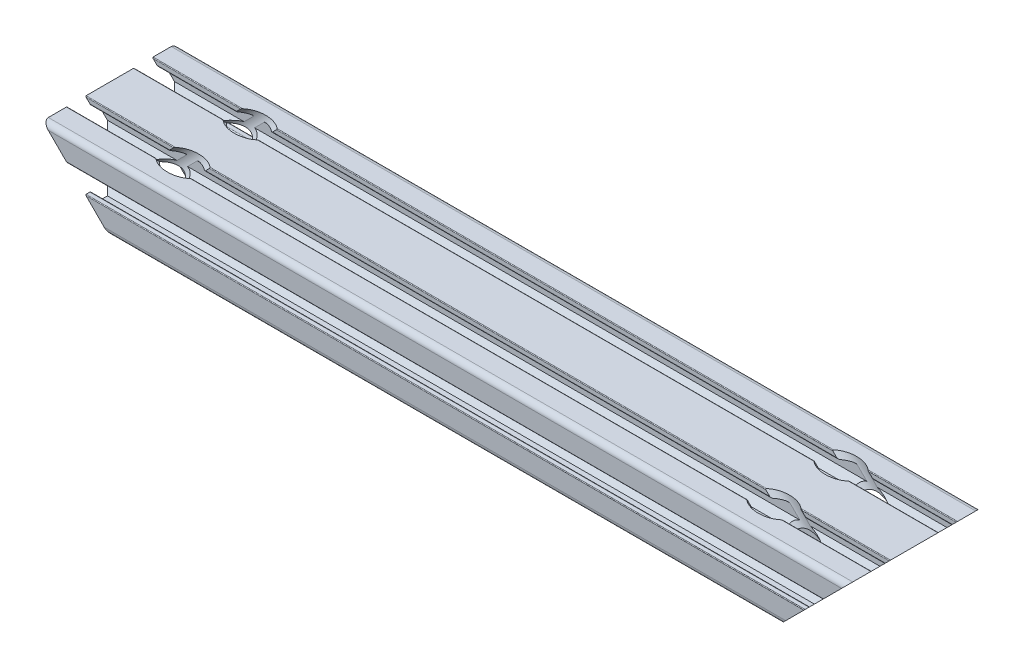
SolidWorks part; units mm, degrees
ref_plane "Front Plane" through (0, 0, 0) normal (0, 0, 1) x (1, 0, 0)
ref_plane "Top Plane" through (0, 0, 0) normal (0, 1, 0) x (1, 0, 0)
ref_plane "Right Plane" through (0, 0, 0) normal (1, 0, 0) x (0, 0, -1)
sketch3d "3DSketch1"
  line L0 (180, 0, 0) -> (-180, 0, 0)
  dimension "D1" = 360
  dimension "D2" = 180
other "30-sarja 1.0012 30X60(1)"
ref_plane "Plane1" through (180, 0, 0) normal (-1, 0, 0) x (0, 1, 0)
sketch "Model" plane through (180, 0, 0) normal (-1, 0, 0) x (0, 1, 0)
  line L0 (-2.0858, 18.5) -> (-3, 18.5)
  line L1 (-3.5, 18) -> (-3.5, 17.0858)
  line L2 (-3.5, 17.0858) -> (-3.3633, 16.9491)
  line L3 (-3.3633, 13.0509) -> (-3.5, 12.9142)
  line L4 (-3.5, 12.9142) -> (-3.5, 12)
  line L5 (-3, 11.5) -> (-2.0858, 11.5)
  line L6 (-2.0858, 11.5) -> (-1.9491, 11.6367)
  line L7 (1.9491, 11.6367) -> (2.0858, 11.5)
  line L8 (2.0858, 11.5) -> (3, 11.5)
  line L9 (3.5, 12) -> (3.5, 12.9142)
  line L10 (3.5, 12.9142) -> (3.3633, 13.0509)
  line L11 (3.3633, 16.9491) -> (3.5, 17.0858)
  line L12 (3.5, 17.0858) -> (3.5, 18)
  line L13 (3, 18.5) -> (2.0858, 18.5)
  line L14 (2.0858, 18.5) -> (1.9491, 18.3633)
  line L15 (-1.9491, 18.3633) -> (-2.0858, 18.5)
  line L16 (-3.5251, -10) -> (3.5251, -10)
  line L17 (4.2322, -9.7071) -> (6.4464, -7.4929)
  line L18 (7.1535, -7.2) -> (13.5, -7.2)
  line L19 (14, -6.7) -> (14, 6.7)
  line L20 (13.5, 7.2) -> (7.1535, 7.2)
  line L21 (6.4464, 7.4929) -> (4.2322, 9.7071)
  line L22 (3.5251, 10) -> (-3.5251, 10)
  line L23 (-4.2322, 9.7071) -> (-6.4464, 7.4929)
  line L24 (-7.1535, 7.2) -> (-13.5, 7.2)
  line L25 (-14, 6.7) -> (-14, -6.7)
  line L26 (-13.5, -7.2) -> (-7.1535, -7.2)
  line L27 (-6.4464, -7.4929) -> (-4.2322, -9.7071)
  line L28 (1.9491, -18.3633) -> (2.0858, -18.5)
  line L29 (2.0858, -18.5) -> (3, -18.5)
  line L30 (3.5, -18) -> (3.5, -17.0858)
  line L31 (3.5, -17.0858) -> (3.3633, -16.9491)
  line L32 (3.3633, -13.0509) -> (3.5, -12.9142)
  line L33 (3.5, -12.9142) -> (3.5, -12)
  line L34 (3, -11.5) -> (2.0858, -11.5)
  line L35 (2.0858, -11.5) -> (1.9491, -11.6367)
  line L36 (-1.9491, -11.6367) -> (-2.0858, -11.5)
  line L37 (-2.0858, -11.5) -> (-3, -11.5)
  line L38 (-3.5, -12) -> (-3.5, -12.9142)
  line L39 (-3.5, -12.9142) -> (-3.3633, -13.0509)
  line L40 (-3.3633, -16.9491) -> (-3.5, -17.0858)
  line L41 (-3.5, -17.0858) -> (-3.5, -18)
  line L42 (-3, -18.5) -> (-2.0858, -18.5)
  line L43 (-2.0858, -18.5) -> (-1.9491, -18.3633)
  line L44 (-6.8, -22.8607) -> (-3.9393, -20)
  line L45 (-6.8, -27.2) -> (-6.8, -22.8607)
  line L46 (-4.6, -27.5) -> (-6.5, -27.5)
  line L47 (-4.1, -29.7) -> (-4.1, -28)
  line L48 (-12.5, -30) -> (-4.4, -30)
  line L49 (-15, -19.4) -> (-15, -27.5)
  line L50 (-13, -19.1) -> (-14.7, -19.1)
  line L51 (-12.5, -21.5) -> (-12.5, -19.6)
  line L52 (-7.8607, -21.8) -> (-12.2, -21.8)
  line L53 (-5, -18.9393) -> (-7.8607, -21.8)
  line L54 (-5, -11.0607) -> (-5, -18.9393)
  line L55 (-7.8607, -8.2) -> (-5, -11.0607)
  line L56 (-12.2, -8.2) -> (-7.8607, -8.2)
  line L57 (-12.5, -10.4) -> (-12.5, -8.5)
  line L58 (-14.7, -10.9) -> (-13, -10.9)
  line L59 (-15, 10.6) -> (-15, -10.6)
  line L60 (-13, 10.9) -> (-14.7, 10.9)
  line L61 (-12.5, 8.5) -> (-12.5, 10.4)
  line L62 (-7.8607, 8.2) -> (-12.2, 8.2)
  line L63 (-5, 11.0607) -> (-7.8607, 8.2)
  line L64 (-5, 18.9393) -> (-5, 11.0607)
  line L65 (-7.8607, 21.8) -> (-5, 18.9393)
  line L66 (-12.2, 21.8) -> (-7.8607, 21.8)
  line L67 (-12.5, 19.6) -> (-12.5, 21.5)
  line L68 (-14.7, 19.1) -> (-13, 19.1)
  line L69 (-15, 27.5) -> (-15, 19.4)
  line L70 (-4.4, 30) -> (-12.5, 30)
  line L71 (-4.1, 28) -> (-4.1, 29.7)
  line L72 (-6.5, 27.5) -> (-4.6, 27.5)
  line L73 (-6.8, 22.8607) -> (-6.8, 27.2)
  line L74 (-3.9393, 20) -> (-6.8, 22.8607)
  line L75 (3.9393, 20) -> (-3.9393, 20)
  line L76 (6.8, 22.8607) -> (3.9393, 20)
  line L77 (6.8, 27.2) -> (6.8, 22.8607)
  line L78 (4.6, 27.5) -> (6.5, 27.5)
  line L79 (4.1, 29.7) -> (4.1, 28)
  line L80 (12.5, 30) -> (4.4, 30)
  line L81 (15, 19.4) -> (15, 27.5)
  line L82 (13, 19.1) -> (14.7, 19.1)
  line L83 (12.5, 21.5) -> (12.5, 19.6)
  line L84 (7.8607, 21.8) -> (12.2, 21.8)
  line L85 (5, 18.9393) -> (7.8607, 21.8)
  line L86 (5, 11.0607) -> (5, 18.9393)
  line L87 (7.8607, 8.2) -> (5, 11.0607)
  line L88 (12.2, 8.2) -> (7.8607, 8.2)
  line L89 (12.5, 10.4) -> (12.5, 8.5)
  line L90 (14.7, 10.9) -> (13, 10.9)
  line L91 (15, -10.6) -> (15, 10.6)
  line L92 (13, -10.9) -> (14.7, -10.9)
  line L93 (12.5, -8.5) -> (12.5, -10.4)
  line L94 (7.8607, -8.2) -> (12.2, -8.2)
  line L95 (5, -11.0607) -> (7.8607, -8.2)
  line L96 (5, -18.9393) -> (5, -11.0607)
  line L97 (7.8607, -21.8) -> (5, -18.9393)
  line L98 (12.2, -21.8) -> (7.8607, -21.8)
  line L99 (12.5, -19.6) -> (12.5, -21.5)
  line L100 (14.7, -19.1) -> (13, -19.1)
  line L101 (15, -27.5) -> (15, -19.4)
  line L102 (4.4, -30) -> (12.5, -30)
  line L103 (4.1, -28) -> (4.1, -29.7)
  line L104 (6.5, -27.5) -> (4.6, -27.5)
  line L105 (6.8, -22.8607) -> (6.8, -27.2)
  line L106 (3.9393, -20) -> (6.8, -22.8607)
  line L107 (-3.9393, -20) -> (3.9393, -20)
  circle A0 centre (10.9, 25.9) radius 3.1
  arc A1 (-3, 18.5) -> (-3.5, 18) centre (-3, 18) ccw
  arc A2 (-3.3056, 16.6059) -> (-3.3633, 16.9491) centre (-3.5754, 16.7369) ccw
  arc A3 (-3.3056, 16.6059) -> (-3.3056, 13.3941) centre (0, 15) ccw
  arc A4 (-3.3633, 13.0509) -> (-3.3056, 13.3941) centre (-3.5754, 13.2631) ccw
  arc A5 (-3.5, 12) -> (-3, 11.5) centre (-3, 12) ccw
  arc A6 (-1.6059, 11.6944) -> (-1.9491, 11.6367) centre (-1.7369, 11.4246) ccw
  arc A7 (-1.6059, 11.6944) -> (1.6059, 11.6944) centre (0, 15) ccw
  arc A8 (1.9491, 11.6367) -> (1.6059, 11.6944) centre (1.7369, 11.4246) ccw
  arc A9 (3, 11.5) -> (3.5, 12) centre (3, 12) ccw
  arc A10 (3.3056, 13.3941) -> (3.3633, 13.0509) centre (3.5754, 13.263) ccw
  arc A11 (3.3056, 13.3941) -> (3.3056, 16.6059) centre (0, 15) ccw
  arc A12 (3.3633, 16.9491) -> (3.3056, 16.6059) centre (3.5754, 16.7369) ccw
  arc A13 (3.5, 18) -> (3, 18.5) centre (3, 18) ccw
  arc A14 (1.6059, 18.3056) -> (1.9491, 18.3633) centre (1.7369, 18.5754) ccw
  arc A15 (1.6059, 18.3056) -> (-1.6059, 18.3056) centre (0, 15) ccw
  arc A16 (-1.9491, 18.3633) -> (-1.6059, 18.3056) centre (-1.7369, 18.5754) ccw
  arc A17 (-4.2322, -9.7071) -> (-3.5251, -10) centre (-3.5251, -9) ccw
  arc A18 (3.5251, -10) -> (4.2322, -9.7071) centre (3.5251, -9) ccw
  arc A19 (7.1535, -7.2) -> (6.4464, -7.4929) centre (7.1535, -8.2) ccw
  arc A20 (13.5, -7.2) -> (14, -6.7) centre (13.5, -6.7) ccw
  arc A21 (14, 6.7) -> (13.5, 7.2) centre (13.5, 6.7) ccw
  arc A22 (6.4464, 7.4929) -> (7.1535, 7.2) centre (7.1535, 8.2) ccw
  arc A23 (4.2322, 9.7071) -> (3.5251, 10) centre (3.5251, 9) ccw
  arc A24 (-3.5251, 10) -> (-4.2322, 9.7071) centre (-3.5251, 9) ccw
  arc A25 (-7.1535, 7.2) -> (-6.4464, 7.4929) centre (-7.1535, 8.2) ccw
  arc A26 (-13.5, 7.2) -> (-14, 6.7) centre (-13.5, 6.7) ccw
  arc A27 (-14, -6.7) -> (-13.5, -7.2) centre (-13.5, -6.7) ccw
  arc A28 (-6.4464, -7.4929) -> (-7.1535, -7.2) centre (-7.1535, -8.2) ccw
  arc A29 (3, -18.5) -> (3.5, -18) centre (3, -18) ccw
  arc A30 (3.3056, -16.6059) -> (3.3633, -16.9491) centre (3.5754, -16.737) ccw
  arc A31 (3.3056, -16.6059) -> (3.3056, -13.3941) centre (0, -15) ccw
  arc A32 (3.3633, -13.0509) -> (3.3056, -13.3941) centre (3.5754, -13.2631) ccw
  arc A33 (3.5, -12) -> (3, -11.5) centre (3, -12) ccw
  arc A34 (1.6059, -11.6944) -> (1.9491, -11.6367) centre (1.7369, -11.4246) ccw
  arc A35 (1.6059, -11.6944) -> (-1.6059, -11.6944) centre (0, -15) ccw
  arc A36 (-1.9491, -11.6367) -> (-1.6059, -11.6944) centre (-1.7369, -11.4246) ccw
  arc A37 (-3, -11.5) -> (-3.5, -12) centre (-3, -12) ccw
  arc A38 (-3.3056, -13.3941) -> (-3.3633, -13.0509) centre (-3.5754, -13.2631) ccw
  arc A39 (-3.3056, -13.3941) -> (-3.3056, -16.6059) centre (0, -15) ccw
  arc A40 (-3.3633, -16.9491) -> (-3.3056, -16.6059) centre (-3.5754, -16.7369) ccw
  arc A41 (-3.5, -18) -> (-3, -18.5) centre (-3, -18) ccw
  arc A42 (-1.6059, -18.3056) -> (-1.9491, -18.3633) centre (-1.7369, -18.5754) ccw
  arc A43 (-1.6059, -18.3056) -> (1.6059, -18.3056) centre (0, -15) ccw
  arc A44 (1.9491, -18.3633) -> (1.6059, -18.3056) centre (1.7369, -18.5754) ccw
  circle A45 centre (-10.9, -25.9) radius 3.1
  arc A46 (-6.8, -27.2) -> (-6.5, -27.5) centre (-6.5, -27.2) ccw
  arc A47 (-4.1, -28) -> (-4.6, -27.5) centre (-4.6, -28) ccw
  arc A48 (-4.4, -30) -> (-4.1, -29.7) centre (-4.4, -29.7) ccw
  arc A49 (-15, -27.5) -> (-12.5, -30) centre (-12.5, -27.5) ccw
  arc A50 (-14.7, -19.1) -> (-15, -19.4) centre (-14.7, -19.4) ccw
  arc A51 (-12.5, -19.6) -> (-13, -19.1) centre (-13, -19.6) ccw
  arc A52 (-12.5, -21.5) -> (-12.2, -21.8) centre (-12.2, -21.5) ccw
  arc A53 (-12.2, -8.2) -> (-12.5, -8.5) centre (-12.2, -8.5) ccw
  arc A54 (-13, -10.9) -> (-12.5, -10.4) centre (-13, -10.4) ccw
  arc A55 (-15, -10.6) -> (-14.7, -10.9) centre (-14.7, -10.6) ccw
  arc A56 (-14.7, 10.9) -> (-15, 10.6) centre (-14.7, 10.6) ccw
  arc A57 (-12.5, 10.4) -> (-13, 10.9) centre (-13, 10.4) ccw
  arc A58 (-12.5, 8.5) -> (-12.2, 8.2) centre (-12.2, 8.5) ccw
  arc A59 (-12.2, 21.8) -> (-12.5, 21.5) centre (-12.2, 21.5) ccw
  arc A60 (-13, 19.1) -> (-12.5, 19.6) centre (-13, 19.6) ccw
  arc A61 (-15, 19.4) -> (-14.7, 19.1) centre (-14.7, 19.4) ccw
  arc A62 (-12.5, 30) -> (-15, 27.5) centre (-12.5, 27.5) ccw
  arc A63 (-4.1, 29.7) -> (-4.4, 30) centre (-4.4, 29.7) ccw
  arc A64 (-4.6, 27.5) -> (-4.1, 28) centre (-4.6, 28) ccw
  arc A65 (-6.5, 27.5) -> (-6.8, 27.2) centre (-6.5, 27.2) ccw
  arc A66 (6.8, 27.2) -> (6.5, 27.5) centre (6.5, 27.2) ccw
  arc A67 (4.1, 28) -> (4.6, 27.5) centre (4.6, 28) ccw
  arc A68 (4.4, 30) -> (4.1, 29.7) centre (4.4, 29.7) ccw
  arc A69 (15, 27.5) -> (12.5, 30) centre (12.5, 27.5) ccw
  arc A70 (14.7, 19.1) -> (15, 19.4) centre (14.7, 19.4) ccw
  arc A71 (12.5, 19.6) -> (13, 19.1) centre (13, 19.6) ccw
  arc A72 (12.5, 21.5) -> (12.2, 21.8) centre (12.2, 21.5) ccw
  arc A73 (12.2, 8.2) -> (12.5, 8.5) centre (12.2, 8.5) ccw
  arc A74 (13, 10.9) -> (12.5, 10.4) centre (13, 10.4) ccw
  arc A75 (15, 10.6) -> (14.7, 10.9) centre (14.7, 10.6) ccw
  arc A76 (14.7, -10.9) -> (15, -10.6) centre (14.7, -10.6) ccw
  arc A77 (12.5, -10.4) -> (13, -10.9) centre (13, -10.4) ccw
  arc A78 (12.5, -8.5) -> (12.2, -8.2) centre (12.2, -8.5) ccw
  arc A79 (12.2, -21.8) -> (12.5, -21.5) centre (12.2, -21.5) ccw
  arc A80 (13, -19.1) -> (12.5, -19.6) centre (13, -19.6) ccw
  arc A81 (15, -19.4) -> (14.7, -19.1) centre (14.7, -19.4) ccw
  arc A82 (12.5, -30) -> (15, -27.5) centre (12.5, -27.5) ccw
  arc A83 (4.1, -29.7) -> (4.4, -30) centre (4.4, -29.7) ccw
  arc A84 (4.6, -27.5) -> (4.1, -28) centre (4.6, -28) ccw
  arc A85 (6.5, -27.5) -> (6.8, -27.2) centre (6.5, -27.2) ccw
  circle A86 centre (10.9, -25.9) radius 3.1
  circle A87 centre (-10.9, 25.9) radius 3.1
  point P278 (0, 0)
  point P279 (15, 0)
  point P280 (-15, 0)
  point P281 (0, -15)
  point P282 (0, 15)
  point P283 (-15, -30)
  point P284 (15, -30)
  point P285 (14.7, -15)
  point P286 (-15, -15)
  point P287 (-15, 15)
  point P288 (-15, 30)
  point P289 (0, 30)
  point P290 (15, 30)
  point P291 (15, 15)
  point P292 (0, -30)
  point P293 (0, 0)
sketch "Sketch2" plane through (0, 0, 30) normal (0, 0, 1) x (1, 0, 0)
  line L0 (180, 15) -> (150, -15)
  line L1 (-180, -15) -> (180, -15) construction
  line L2 (150, -15) -> (180, -15)
  line L3 (180, -15) -> (180, 15)
  line L4 (0, -16.5) -> (0, 16.5) construction
  line L5 (-150, -15) -> (-180, -15)
  line L6 (-180, 15) -> (-150, -15)
  line L7 (-180, -15) -> (-180, 15)
  point P11 (0, 0)
  point P12 (0, 0)
  point P14 (0, 0)
  point P15 (0, 0)
  point P16 (0, 0)
  point P18 (0, 0)
  dimension "D1" = 45
extrude "Cut-Extrude1" cut sketch "Sketch2" against normal through all
sketch "Sketch3" plane through (82.5, -82.5, 0) normal (0.7071, -0.7071, 0) x (0, 0, -1)
  line L0 (-11.0607, 109.6016) -> (-18.9393, 109.6016) construction
  line L1 (0, 16.5) -> (0, -16.5) construction
  point P0 (-15, 104.1016)
  point P5 (15, 104.1016)
  dimension "D1" = 5.5
hole_wizard "Ø8.5 (8.5) Diameter Hole1" positions "Sketch3" profile "Sketch4" hole size "Ø8.5" standard "DIN"
sketch "Sketch4" plane through (156.1109, -8.8891, 15) normal (0, 0, 1) x (0.7071, 0.7071, 0)
  line L0 (0, 0) -> (0, 254.5584)
  line L1 (0, 254.5584) -> (4.25, 254.5584)
  line L2 (4.25, 254.5584) -> (4.25, 0)
  line L5 (4.25, 0) -> (0, 0)
  line L11 (0, -6.35) -> (0, 107.95) construction
  dimension "Thru Hole Dia." = 8.5
  dimension "Thru Hole Depth" = 254.5584
mirror "Mirror1" about plane through (0, 0, 0) normal (1, 0, 0) of "Ø8.5 (8.5) Diameter Hole1"
ref_plane "Plane2" through (50.6802, -50.6802, 0) normal (0.7071, -0.7071, 0) x (0, 0, -1)
sketch "Sketch5" plane through (50.6802, -50.6802, 0) normal (0.7071, -0.7071, 0) x (0, 0, -1)
  point P0 (15, 104.1016)
  point P1 (-15, 104.1016)
hole_wizard "CBORE for M8 Hex Head Bolt2" positions "Sketch5" profile "Sketch6" counterbore size "M8" standard "DIN"
sketch "Sketch6" plane through (124.2911, 22.9307, -15) normal (0, 0, 1) x (-0.7071, -0.7071, 0)
  line L0 (0, 0) -> (0, 66.2132)
  line L1 (0, 66.2132) -> (4.2, 66.2132)
  line L3 (4.2, 66.2132) -> (4.2, 30)
  line L4 (4.2, 30) -> (7, 30)
  line L5 (7, 30) -> (7, 0)
  line L7 (7, 0) -> (0, 0)
  line L11 (0, -6.35) -> (0, 107.95) construction
  dimension "Thru Hole Dia." = 8.4
  dimension "Thru Hole Depth" = 66.2132
  dimension "C'Bore Dia." = 14
  dimension "C'Bore Depth" = 30
mirror "Mirror2" about plane through (0, 0, 0) normal (1, 0, 0) of "CBORE for M8 Hex Head Bolt2"
